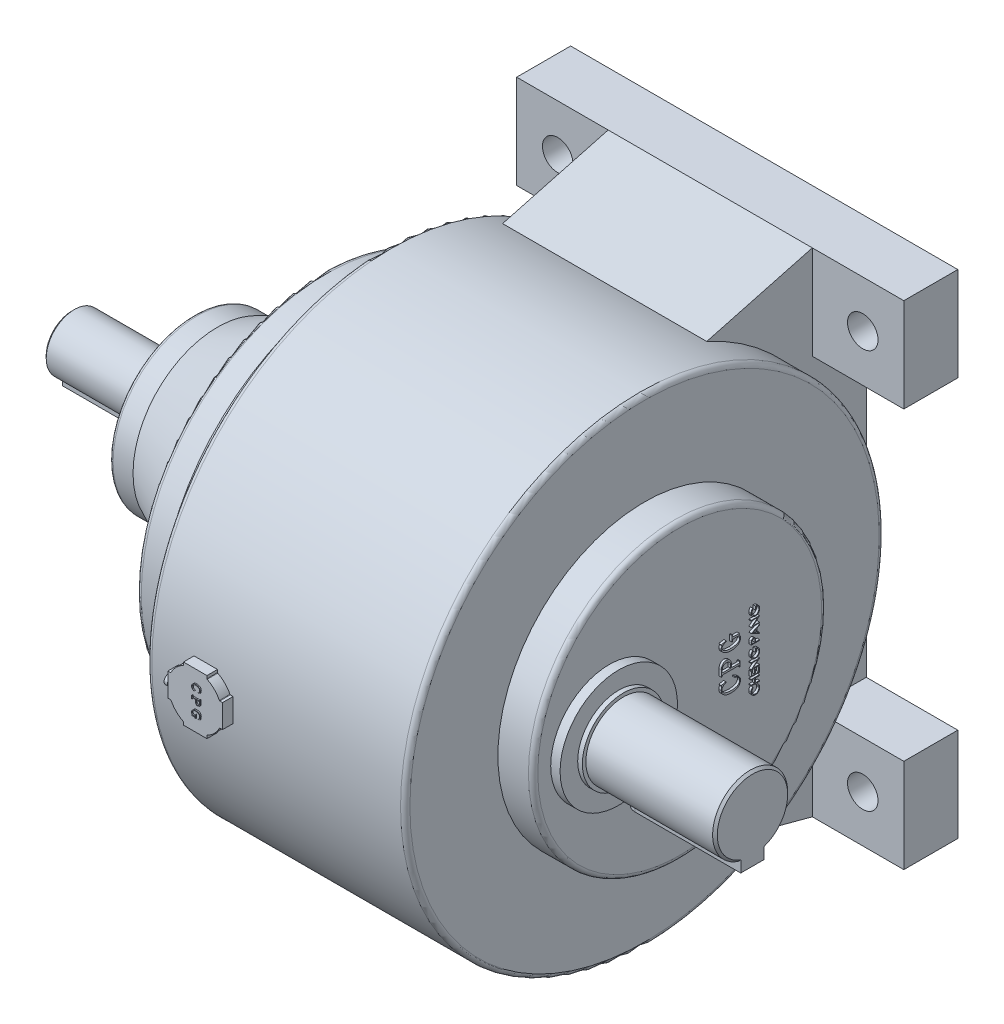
SolidWorks part; units mm, degrees
ref_plane "前视基准面" through (0, 0, 0) normal (0, 0, 1) x (1, 0, 0)
ref_plane "上视基准面" through (0, 0, 0) normal (0, 1, 0) x (1, 0, 0)
ref_plane "右视基准面" through (0, 0, 0) normal (1, 0, 0) x (0, 0, -1)
ref_plane "基准面1" through (0, 0, -140) normal (0, 0, 1) x (1, 0, 0)
sketch "草图1" plane through (0, 0, 0) normal (0, 1, 0) x (1, 0, 0)
  line L0 (0, 0) -> (33.1729, 0) construction
  line L1 (0, 0) -> (0, -16)
  line L2 (0, -16) -> (-55, -16)
  line L3 (-55, -16) -> (-55, -17.5)
  line L4 (-55, -17.5) -> (-57, -17.5)
  line L5 (-57, -17.5) -> (-57, -25)
  line L6 (-57, -25) -> (-61, -25)
  line L7 (-61, -25) -> (-61, 0)
  line L8 (-61, 0) -> (0, 0)
  dimension "D1" = 55
  dimension "D2" = 32
  dimension "D3" = 35
  dimension "D4" = 2
  dimension "D5" = 50
  dimension "D6" = 4
revolve "旋转1" add sketch "草图1" angle 360 about L0
sketch "草图2" plane through (0, 0, 0) normal (0, 1, 0) x (1, 0, 0)
  line L0 (8.0167, 30) -> (-61, 30) construction
  line L1 (-61, 30) -> (-61, -32.5)
  line L2 (-61, 25) -> (-61, -25) construction
  line L3 (-61, -32.5) -> (-76, -32.5)
  line L4 (-76, -32.5) -> (-76, -72)
  line L5 (-76, -72) -> (-186, -72)
  line L6 (-186, -72) -> (-186, 30)
  line L11 (-61, 30) -> (-186, 30)
  line L13 (-103.125, 140) -> (103.125, 140) construction
  dimension "D1" = 30
  dimension "D2" = 125
  dimension "D3" = 15
  dimension "D4" = 212
  dimension "D5" = 110
revolve "旋转2" add sketch "草图2" angle 360 about L0
sketch "草图3" plane through (0, 0, -140) normal (0, 0, 1) x (1, 0, 0)
  line L0 (0, 0) -> (40.0459, 0) construction
  line L1 (-217.5, -65) -> (-52.5, -65)
  line L2 (-217.5, -65) -> (-217.5, -105)
  line L3 (-217.5, -105) -> (-52.5, -105)
  line L4 (-52.5, -65) -> (-52.5, -105)
  line L5 (0, -16) -> (0, 16) construction
  circle A0 centre (-70, -85) radius 6.5
  circle A1 centre (-200, -85) radius 6.5
  dimension "D2" = 170
  dimension "D3" = 13
  dimension "D4" = 130
  dimension "D6" = 70
  dimension "D8" = 40
  dimension "D1" = 210
  dimension "D5" = 165
  dimension "D7" = 17.5
extrude "拉伸2" add sketch "草图3" along normal blind 23
mirror "镜向2" about plane through (0, 0, 0) normal (0, 1, 0)
ref_plane "基准面4" through (-135, 0, 0) normal (1, 0, 0) x (0, 0, -1)
sketch "草图4" plane through (-135, 0, 0) normal (1, 0, 0) x (0, 0, -1)
  line L0 (117, 65) -> (140, 65) construction
  line L1 (117, 65) -> (140, 65)
  line L2 (117, 105) -> (117, 65) construction
  line L3 (117, 105) -> (117, 65)
  line L4 (117, -65) -> (140, -65) construction
  line L5 (117, -65) -> (140, -65)
  line L6 (117, -105) -> (117, -65) construction
  line L7 (117, -105) -> (117, -65)
  line L8 (140, 65) -> (140, -65)
  line L9 (117, 105) -> (72, 92.9516)
  line L11 (72, -92.9516) -> (117, -105)
  arc A1 (72, -92.9516) -> (72, 92.9516) centre (30, 0) ccw
  circle A2 centre (30, 0) radius 102 construction
  dimension "D1" = 45
extrude "拉伸3" add sketch "草图4" against normal mid plane 87
sketch "草图5" plane through (0, 0, 0) normal (0, 1, 0) x (1, 0, 0)
  line L0 (0, -5) -> (-45, -5)
  line L1 (0, -16) -> (0, 16) construction
  line L2 (-45, 5) -> (0, 5)
  line L3 (0, 5) -> (0, -5)
  line L4 (35.5, -13.7955) -> (35.5, 19.6443) construction
  arc A0 (-45, -5) -> (-45, 5) centre (-45, 0) cw
  dimension "D2" = 50
  dimension "D1" = 10
  dimension "D3" = 35.5
extrude "拉伸4" add sketch "草图5" against normal blind 19
fillet "圆角1" radius 2 3 edges at (-186, 0, -132) (-76, 0, -132) (-61, 0, -92.5)
chamfer "倒角1" distance 1 angle 45 1 edges at (0, 16, 0)
sketch "草圖2"
extrude "伸長1" add sketch "草圖2" along normal blind 1
sketch "草圖3" plane through (0, 0, 0) normal (0, 1, 0) x (1, 0, 0)
  line L0 (-269.0797, 30) -> (-111.2984, 30) construction
  line L1 (-186, 30) -> (-320, 30)
  line L2 (-197.5, 109) -> (-211.5, 109)
  line L3 (-320, 41) -> (-319, 42)
  line L5 (-213.5, 86.5) -> (-258, 66)
  line L6 (-271.5, 42) -> (-271.5, 41.95)
  line L7 (0, -5) -> (0, 5) construction
  line L8 (-197, 116) -> (-186, 116)
  line L9 (-266.5, 66) -> (-258, 66)
  line L10 (-213.5, 107) -> (-213.5, 86.5)
  line L11 (-271.5, 42) -> (-319, 42)
  line L12 (-270, 41.95) -> (-271.5, 41.95)
  line L13 (-269.5, 43.75) -> (-270, 43.45)
  line L14 (-320, 30) -> (-320, 41)
  line L15 (-186, 130) -> (-186, -70) construction
  line L16 (-268, 43.75) -> (-269.5, 43.75)
  line L17 (-186, 116) -> (-186, 30)
  line L18 (-197, 116) -> (-197, 108.5)
  line L19 (-270, 43.45) -> (-270, 41.95)
  line L20 (-268, 43.75) -> (-268, 64.5)
  arc A0 (-197, 108.5) -> (-197.5, 109) centre (-197.5, 108.5) ccw
  arc A1 (-197, 108.5) -> (-197.5, 109) centre (-197.5, 108.5) ccw
  arc A2 (-266.5, 66) -> (-268, 64.5) centre (-266.5, 64.5) ccw
  arc A3 (-211.5, 109) -> (-213.5, 107) centre (-211.5, 107) ccw
  point P8 (0, 0)
  point P19 (-320, 42)
  point P21 (0, 0)
  dimension "D6" = 320
  dimension "D1" = 30
  dimension "D2" = 24
  dimension "D3" = 50
  dimension "D4" = 72
  dimension "D5" = 158
revolve "旋轉1" add sketch "草圖3" angle 360 about L0
sketch "草圖4" plane through (0, 0, 0) normal (0, 1, 0) x (1, 0, 0)
  line L0 (-329.033, 30) -> (-251.2427, 30) construction
  line L1 (-320, 26) -> (-279, 26)
  line L2 (-320, 41) -> (-320, 19) construction
  line L3 (-279, 34) -> (-320, 34)
  line L4 (-320, 34) -> (-320, 26)
  line L5 (-275, 30) -> (-275, -1.6707) construction
  line L6 (-271.5, 42) -> (-319, 42) construction
  arc A0 (-279, 26) -> (-279, 34) centre (-279, 30) ccw
  dimension "D1" = 8
  dimension "D2" = 4
  dimension "D3" = 45
  dimension "D4" = 12
extrude "伸長2" add sketch "草圖4" against normal blind 14.7
ref_plane "平面1" through (0, 0, 76.5) normal (0, 0, 1) x (1, 0, 0)
sketch "草圖5" plane through (0, 0, 76.5) normal (0, 0, 1) x (1, 0, 0)
  line L0 (-166, 11.65) -> (-156, 11.65)
  line L1 (-166, 11.65) -> (-166, 10.5119)
  line L2 (-156, 11.65) -> (-156, 10.5119)
  line L3 (-166, -10.5119) -> (-166, -11.65)
  line L4 (-156, -10.5119) -> (-156, -11.65)
  line L5 (-172.65, 5) -> (-171.5119, 5)
  line L6 (-172.65, -5) -> (-171.5119, -5)
  line L7 (-172.65, -5) -> (-172.65, 5)
  line L8 (-166, -11.65) -> (-166, -10.5119)
  line L9 (-156, -11.65) -> (-156, -10.5119)
  line L10 (-156, -11.65) -> (-166, -11.65)
  line L11 (-149.35, -5) -> (-150.4881, -5)
  line L12 (-149.35, 5) -> (-150.4881, 5)
  line L13 (-149.35, 5) -> (-149.35, -5)
  arc A0 (-166.1383, 10.2882) -> (-171.2882, 5.1383) centre (-161, 0) ccw
  arc A1 (-166.1383, 10.2882) -> (-166, 10.5119) centre (-166.25, 10.5119) ccw
  arc A2 (-156, 10.5119) -> (-155.8617, 10.2882) centre (-155.75, 10.5119) ccw
  arc A3 (-171.5119, 5) -> (-171.2882, 5.1383) centre (-171.5119, 5.25) ccw
  arc A4 (-171.2882, -5.1383) -> (-171.5119, -5) centre (-171.5119, -5.25) ccw
  arc A5 (-166, -10.5119) -> (-166.1383, -10.2882) centre (-166.25, -10.5119) ccw
  arc A6 (-155.8617, -10.2882) -> (-156, -10.5119) centre (-155.75, -10.5119) ccw
  arc A7 (-150.4881, -5) -> (-150.7118, -5.1383) centre (-150.4881, -5.25) ccw
  arc A8 (-150.7118, 5.1383) -> (-150.4881, 5) centre (-150.4881, 5.25) ccw
  arc A9 (-150.7118, 5.1383) -> (-155.8617, 10.2882) centre (-161, 0) ccw
  arc A10 (-171.2882, -5.1383) -> (-166.1383, -10.2882) centre (-161, 0) ccw
  arc A11 (-155.8617, -10.2882) -> (-150.7118, -5.1383) centre (-161, 0) ccw
  dimension "D1" = 11.5
extrude "伸長3" add sketch "草圖5" against normal blind 4.5 separate body contours A6 A11 A7 L11 L13 L12 A8 A9 A2 L2 L0 L1 A1 A0 A3 L5 L7 L6 A4 A10 A5 L3 L10 L4
sketch "草圖6"
extrude "伸長4" add sketch "草圖6" along normal blind 0.5
sketch "草圖7" plane through (0, 0, 0) normal (0, 1, 0) x (1, 0, 0)
  line L0 (-174.5404, -74.25) -> (-166.5404, -74.25)
  line L1 (-174.5404, -74.25) -> (-174.5404, -72.25)
  line L2 (-173.0404, -73) -> (-173.0404, -72.25)
  line L13 (-171.0404, -73) -> (-166.5404, -73.25)
  line L15 (-173.0404, -73) -> (-171.0404, -73)
  line L23 (-174.5404, -72.25) -> (-173.0404, -72.25)
  line L24 (-171.0404, -74.25) -> (-171.0404, -73)
  line L25 (-166.5404, -74.25) -> (-166.5404, -73.25)
revolve "旋轉2" add sketch "草圖7" angle 360 about L0
equation "\"D7@草图3\"=(\"D5@草图3\"-\"D4@草图3\")/2"
equation "\"D8@草图3\"=\"D1@草图3\"-\"D2@草图3\""
equation "\"D1@拉伸4\"=\"D3@草图5\"-\"D2@草图1\"/2"
equation "\"D3@草图1\"=\"D2@草图1\"+3"
equation "\"D1@基准面4\"=\"D5@草图3\"/2"
equation "\"D1@拉伸3\"=\"D4@草图3\"-\"D3@草图3\"-30"
equation "\"D5@草图2\"=\"D4@草图3\"-20"
